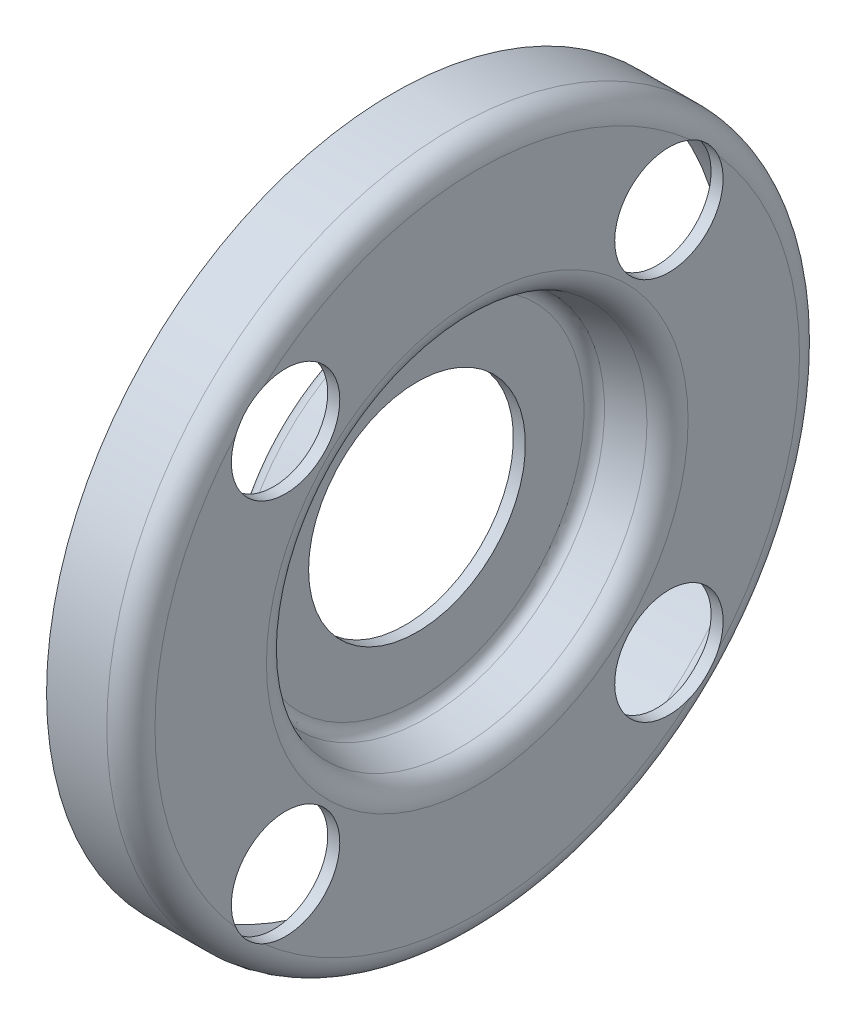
SolidWorks part; units mm, degrees
ref_plane "Plan1" through (0, 0, 0) normal (0, 0, 1) x (1, 0, 0)
ref_plane "Plan2" through (0, 0, 0) normal (0, 1, 0) x (1, 0, 0)
ref_plane "Plan3" through (0, 0, 0) normal (1, 0, 0) x (0, 0, -1)
sketch "Esquisse1" plane through (0, 0, 0) normal (0, 0, 1) x (1, 0, 0)
  line L0 (0, 0) -> (67, 0) construction
  line L1 (0, 18) -> (0, 27.7165)
  line L2 (2.9647, 31.5802) -> (8.5176, 33.0681)
  line L3 (10, 35) -> (10, 53.5)
  line L4 (8, 55.5) -> (-2, 55.5)
  arc A0 (10, 53.5) -> (8, 55.5) centre (8, 53.5) ccw
  arc A1 (8.5176, 33.0681) -> (10, 35) centre (8, 35) ccw
  arc A2 (2.9647, 31.5802) -> (0, 27.7165) centre (4, 27.7165) ccw
  dimension "D1" = 2
  dimension "D2" = 4
  dimension "D3" = 36
  dimension "D4" = 111
  dimension "D5" = 75
  dimension "D6" = 12
  dimension "D7" = 2
  dimension "D8" = 70
revolve "Base-Révol.-Mince" add sketch "Esquisse1" angle 360 about L0
sketch "Esquisse2" plane through (0, 0, 0) normal (1, 0, 0) x (0, 0, -1)
  line L0 (-31.8198, -31.8198) -> (31.8198, 31.8198) construction
  line L1 (31.8198, -31.8198) -> (-31.8198, 31.8198) construction
  circle A0 centre (0, 0) radius 45 construction
  circle A1 centre (31.8198, 31.8198) radius 9
  circle A2 centre (-31.8198, 31.8198) radius 9
  circle A3 centre (31.8198, -31.8198) radius 9
  circle A4 centre (-31.8198, -31.8198) radius 9
  circle A5 centre (0, 0) radius 57.5 construction
  dimension "D1" = 90
  dimension "D2" = 18
extrude "Enlèv. mat.-Extru.3" cut sketch "Esquisse2" along normal through all
